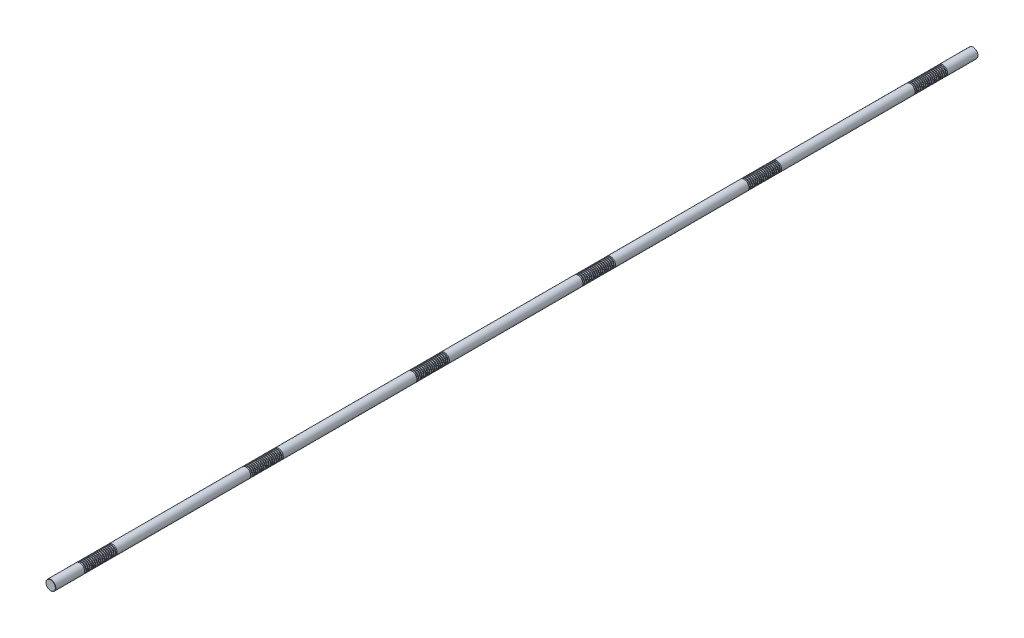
SolidWorks part; units mm, degrees
ref_plane "Front Plane" through (0, 0, 0) normal (0, 0, 1) x (1, 0, 0)
ref_plane "Top Plane" through (0, 0, 0) normal (0, 1, 0) x (1, 0, 0)
ref_plane "Right Plane" through (0, 0, 0) normal (1, 0, 0) x (0, 0, -1)
sketch "Sketch1" plane through (0, 0, 0) normal (0, 0, 1) x (1, 0, 0)
  circle A0 centre (0, 0) radius 16
  dimension "D1" = 32
extrude "Boss-Extrude1" add sketch "Sketch1" along normal mid plane 3000
chamfer "Chamfer1" distance 0.8 angle 45 2 edges at (16, 0, -1500) (16, 0, 1500)
sketch "Sketch2" plane through (0, 0, 0) normal (1, 0, 0) x (0, 0, -1)
  line L0 (1400.4689, 16) -> (1396.5311, 16)
  line L1 (1499.2, 16) -> (-1499.2, 16) construction
  line L2 (1396.5311, 16) -> (1397.4689, 12.5)
  line L3 (1397.4689, 12.5) -> (1399.5311, 12.5)
  line L4 (1399.5311, 12.5) -> (1400.4689, 16)
  line L5 (1500, -15.2) -> (1500, 15.2) construction
  point P4 (1398.5, 16)
  point P7 (1398.5, 12.5)
  point P8 (1400, 14.25)
  point P9 (1397, 14.25)
  dimension "D1" = 3
  dimension "D2" = 100
  dimension "D3" = 3.5
  dimension "D4" = 30
revolve "Cut-Revolve1" cut sketch "Sketch2" angle 360 about axis through (0, 0, 1500) along (0, 0, -1)
pattern_linear "LPattern1" count 18 spacing 6 along (0, 0, 1) of "Cut-Revolve1"
pattern_linear "LPattern2" count 6 spacing 540 along (0, 0, 1) of "Cut-Revolve1", "LPattern1"
